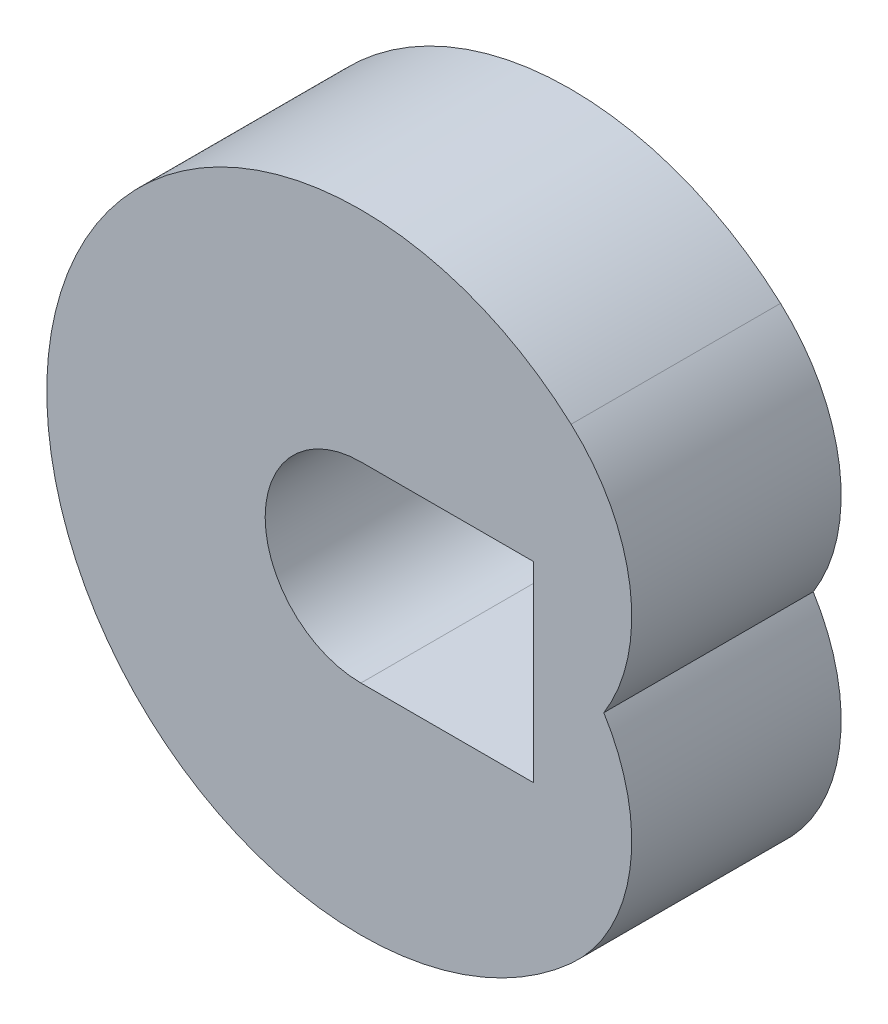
SolidWorks part; units mm, degrees
ref_plane "前视基准面" through (0, 0, 0) normal (0, 0, 1) x (1, 0, 0)
ref_plane "上视基准面" through (0, 0, 0) normal (0, 1, 0) x (1, 0, 0)
ref_plane "右视基准面" through (0, 0, 0) normal (1, 0, 0) x (0, 0, -1)
sketch "草图1" plane through (0, 0, 0) normal (0, 0, 1) x (1, 0, 0)
  line L0 (0, 0) -> (401.4784, 445.8869) construction
  line L1 (0, 0) -> (401.4784, -445.8869) construction
  line L2 (0, 0) -> (-791.161, 0) construction
  line L3 (0, 0) -> (-250, 0) construction
  line L4 (0, 182.8813) -> (330, 182.8813)
  line L5 (330, 182.8813) -> (330, -182.8813)
  line L6 (330, -182.8813) -> (0, -182.8813)
  arc A0 (401.4784, 445.8869) -> (401.4784, -445.8869) centre (0, 0) ccw
  arc A1 (401.4784, 445.8869) -> (463.9028, 0) centre (167.2827, 185.7862) cw
  arc A2 (401.4784, -445.8869) -> (463.9028, 0) centre (167.2827, -185.7862) ccw
  arc A3 (0, 182.8813) -> (0, -182.8813) centre (0, 0) ccw
  dimension "D1" = 600
  dimension "D2" = 250
  dimension "D3" = 132
  dimension "D4" = 330
extrude "凸台-拉伸1" add sketch "草图1" along normal blind 400 contours A0 A2 A1 | L4 L5 L6 A3
